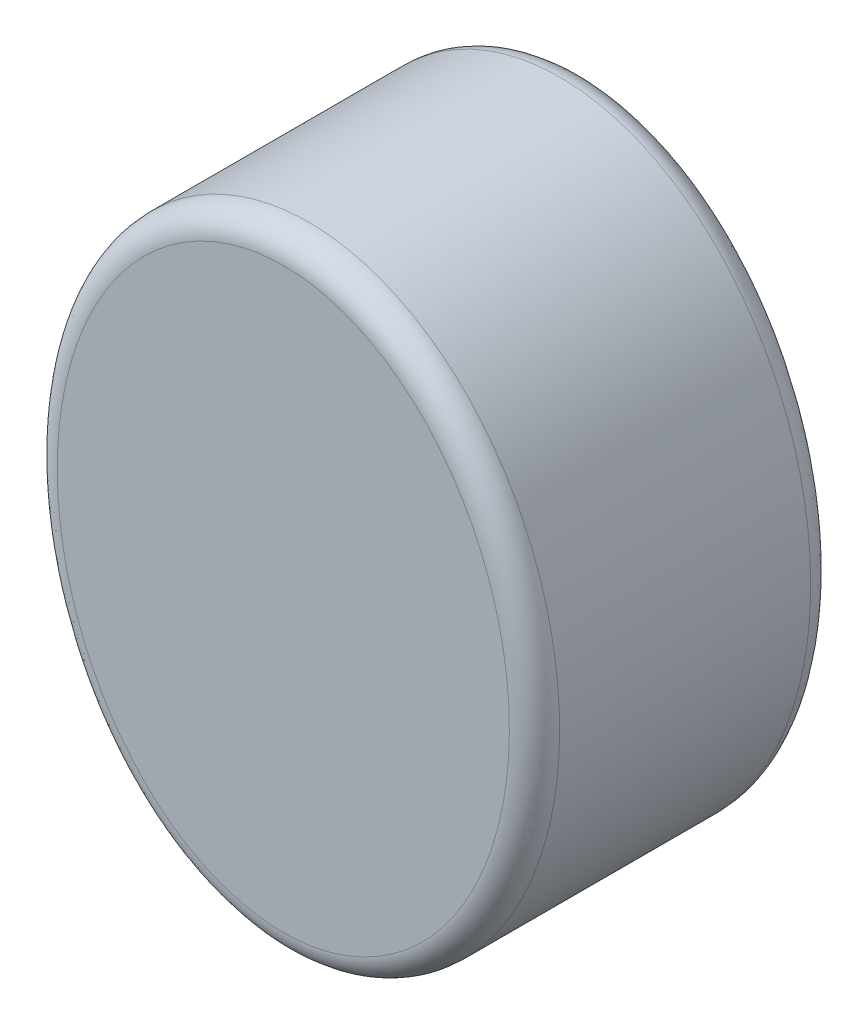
SolidWorks part; units mm, degrees
ref_plane "Front" through (0, 0, 0) normal (0, 0, 1) x (1, 0, 0)
ref_plane "Top" through (0, 0, 0) normal (0, 1, 0) x (1, 0, 0)
ref_plane "Right" through (0, 0, 0) normal (1, 0, 0) x (0, 0, -1)
sketch "Esquisse1" plane through (0, 0, 0) normal (0, 0, 1) x (1, 0, 0)
  ellipse E0 centre (0, 0) end of major axis (0, -12.5) minor radius 10
  dimension "D3" = 25
  dimension "D4" = 20
extrude "Boss.-Extru.1" add sketch "Esquisse1" along normal blind 12 contours E0
fillet "Congé1" radius 1 2 edges at (0, -12.5, 0) (0, -12.5, 12)
